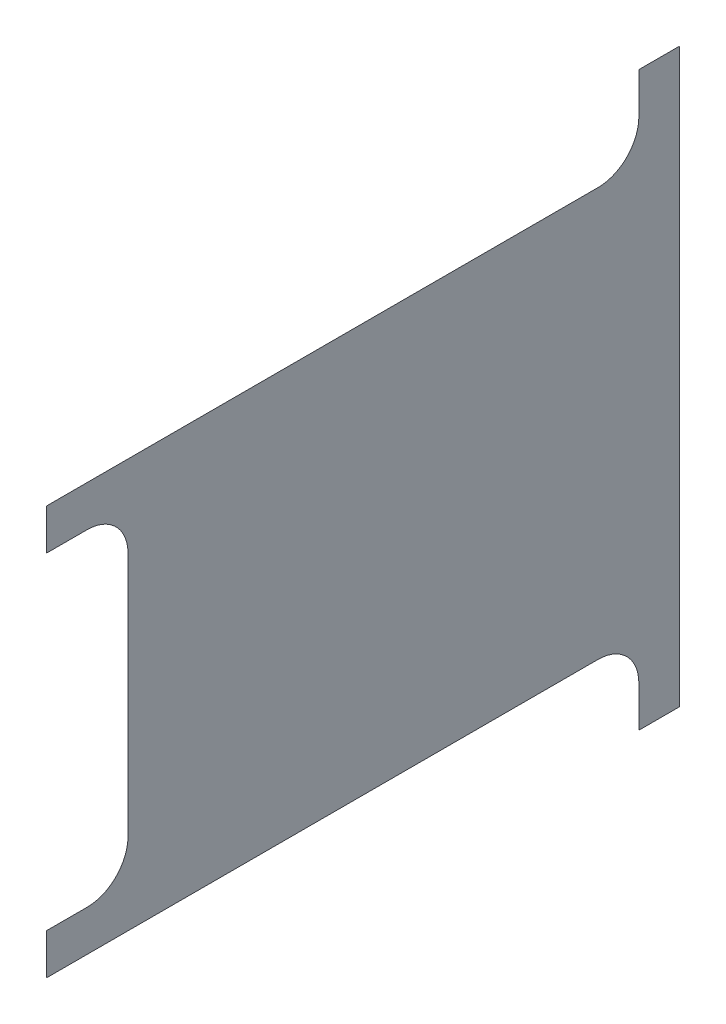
SolidWorks part; units mm, degrees
ref_plane "Front Plane" through (0, 0, 0) normal (0, 0, 1) x (1, 0, 0)
ref_plane "Top Plane" through (0, 0, 0) normal (0, 1, 0) x (1, 0, 0)
ref_plane "Right Plane" through (0, 0, 0) normal (1, 0, 0) x (0, 0, -1)
sketch "Sketch1" plane through (584.2, 0, 0) normal (1, 0, 0) x (0, 0, -1)
  line L0 (0, 0) -> (279.3127, 0) construction
  line L1 (0, 0) -> (0, 111.2688) construction
  line L2 (25.4, -50.8) -> (25.4, -63.5)
  line L3 (25.4, -63.5) -> (196.85, -63.5)
  line L4 (25.4, 63.5) -> (196.85, 63.5)
  line L5 (38.1, 50.8) -> (-38.1, 50.8) construction
  line L6 (50.8, -38.1) -> (50.8, 38.1) construction
  line L7 (-38.1, -50.8) -> (38.1, -50.8) construction
  line L8 (38.1, 50.8) -> (25.4, 50.8)
  line L9 (50.8, -38.1) -> (50.8, 38.1)
  line L10 (25.4, -50.8) -> (38.1, -50.8)
  line L11 (209.55, 76.2) -> (209.55, 88.9)
  line L13 (25.4, 63.5) -> (25.4, 50.8)
  line L14 (209.55, 88.9) -> (222.25, 88.9)
  line L15 (222.25, 88.9) -> (222.25, -88.9)
  line L16 (222.25, -88.9) -> (209.55, -88.9)
  line L17 (209.55, -88.9) -> (209.55, -76.2)
  arc A0 (196.85, 63.5) -> (209.55, 76.2) centre (196.85, 76.2) ccw
  arc A1 (209.55, -76.2) -> (196.85, -63.5) centre (196.85, -76.2) ccw
  arc A2 (50.8, 38.1) -> (38.1, 50.8) centre (38.1, 38.1) ccw construction
  arc A3 (38.1, -50.8) -> (50.8, -38.1) centre (38.1, -38.1) ccw construction
  arc A4 (50.8, 38.1) -> (38.1, 50.8) centre (38.1, 38.1) ccw
  arc A5 (38.1, -50.8) -> (50.8, -38.1) centre (38.1, -38.1) ccw
  dimension "D4" = 12.7
  dimension "D5" = 25.4
  dimension "D1" = 127
  dimension "D2" = 63.5
  dimension "D3" = 25.4
  dimension "D6" = 177.8
  dimension "D7" = 88.9
  dimension "D8" = 12.7
  dimension "D9" = 196.85
surface "Surface-Plane1" sketch "Sketch1"
